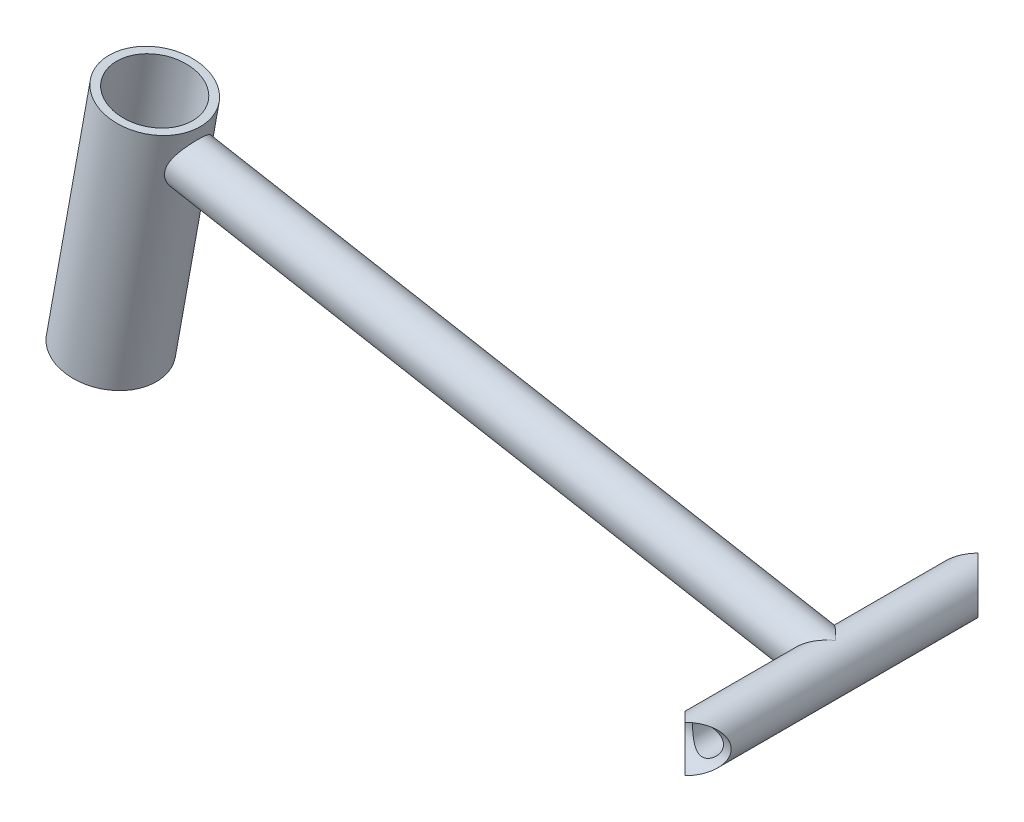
SolidWorks part; units mm, degrees
ref_plane "Face" through (0, 0, 0) normal (0, 0, 1) x (1, 0, 0)
ref_plane "Dessus" through (0, 0, 0) normal (0, 1, 0) x (1, 0, 0)
ref_plane "Droite" through (0, 0, 0) normal (1, 0, 0) x (0, 0, -1)
sketch "Esquisse1" plane through (0, 0, 0) normal (0, 0, 1) x (1, 0, 0)
  line L0 (-442.8318, 80) -> (0, 0) construction
  line L1 (-426.2154, 171.9786) -> (-463.1361, -32.3926) construction
  line L2 (-440.1651, 94.7611) -> (2.6667, 14.7611)
  line L3 (0, 0) -> (17.1191, 94.7611) construction
  dimension "D1" = 30
  dimension "D2" = 450
  dimension "D3" = 80
revolve "Révol.-Mince2" add sketch "Esquisse1" angle 360 about L0
sketch "Esquisse2" plane through (0, 0, 0) normal (0, 0, 1) x (1, 0, 0)
  line L0 (-426.2154, 171.9786) -> (-463.1361, -32.3926) construction
  line L1 (-426.2154, 171.9786) -> (-463.1361, -32.3926) construction
  line L2 (-409.2208, 97.3003) -> (-417.9319, 49.0808)
  line L3 (-409.2208, 97.3003) -> (-438.7429, 102.6336)
  line L4 (-445.4985, 65.2389) -> (-2.6667, -14.7611) construction
  line L5 (-417.9319, 49.0808) -> (-447.454, 54.4142)
  line L9 (-442.8318, 80) -> (0, 0) construction
  line L10 (-440.1651, 94.7611) -> (2.6667, 14.7611) construction
  line L11 (-438.7429, 102.6336) -> (-447.454, 54.4142)
  dimension "D1" = 30
  dimension "D2" = 11
  dimension "D3" = 8
revolve "Enlèvement de matière-Révolution1" cut sketch "Esquisse2" angle 360 about L1
sketch "Esquisse3" plane through (0, 0, 0) normal (0, 0, 1) x (1, 0, 0)
  circle A0 centre (0, 0) radius 15
  dimension "D1" = 30
extrude "Enlèv. mat.-Extru.1" cut sketch "Esquisse3" against normal mid plane 40
sketch "Esquisse4" plane through (0, 0, 0) normal (0, 0, 1) x (1, 0, 0)
  circle A0 centre (0, 0) radius 15
  arc A1 (2.6667, 14.7611) -> (-2.6667, -14.7611) centre (0, 0) ccw construction
  circle A2 centre (0, 0) radius 10
  dimension "D1" = 20
extrude "Extrusion1" add sketch "Esquisse4" along normal mid plane 190
sketch "Esquisse5" plane through (0, 0, 0) normal (0, 0, 1) x (1, 0, 0)
  line L0 (-426.2154, 171.9786) -> (-463.1361, -32.3926) construction
  line L1 (-426.2154, 171.9786) -> (-468.9084, -64.3442) construction
  line L2 (-409.2208, 97.3003) -> (-437.6652, -60.151)
  line L4 (-414.1411, 98.1892) -> (-442.5856, -59.2621)
  line L5 (-409.2208, 97.3003) -> (-414.1411, 98.1892)
  line L7 (-442.8318, 80) -> (0, 0) construction
  line L8 (-440.1651, 94.7611) -> (2.6667, 14.7611) construction
  line L9 (-437.6652, -60.151) -> (-442.5856, -59.2621)
  dimension "D1" = 60
  dimension "D2" = 8
  dimension "D3" = 160
  dimension "D4" = 5
revolve "Révolution1" add sketch "Esquisse5" angle 360 about L1
sketch "Esquisse6" plane through (0, 0, 0) normal (0, 1, 0) x (1, 0, 0)
  line L0 (-258.7766, -95) -> (119.6041, -95) construction
  line L2 (-20, -80) -> (20, -80)
  line L3 (-20, -80) -> (-20, -95)
  line L4 (-20, -95) -> (20, -95)
  line L5 (20, -80) -> (20, -95)
  line L6 (15, -95) -> (15, 95) construction
  line L7 (-15, -14.7611) -> (-15, -95) construction
  line L8 (275.0342, -80) -> (-347.7474, -80) construction
  dimension "D1" = 95
  dimension "D2" = 5
  dimension "D3" = 5
revolve "Enlèvement de matière-Révolution2" cut sketch "Esquisse6" angle 360 about L0
sketch "Esquisse7" plane through (0, 0, 0) normal (0, 1, 0) x (1, 0, 0)
  line L0 (281.2414, 95) -> (-347.7469, 95) construction
  line L1 (-48.1337, 95) -> (44.7925, 95)
  line L2 (-48.1337, 95) -> (-48.1337, 80)
  line L3 (-48.1337, 80) -> (44.7925, 80)
  line L4 (44.7925, 95) -> (44.7925, 80)
  line L5 (-85.1589, 95) -> (93.4335, 95) construction
  line L6 (-347.7469, 80) -> (281.2414, 80) construction
revolve "Enlèvement de matière-Révolution4" cut sketch "Esquisse7" angle 360 about L5
